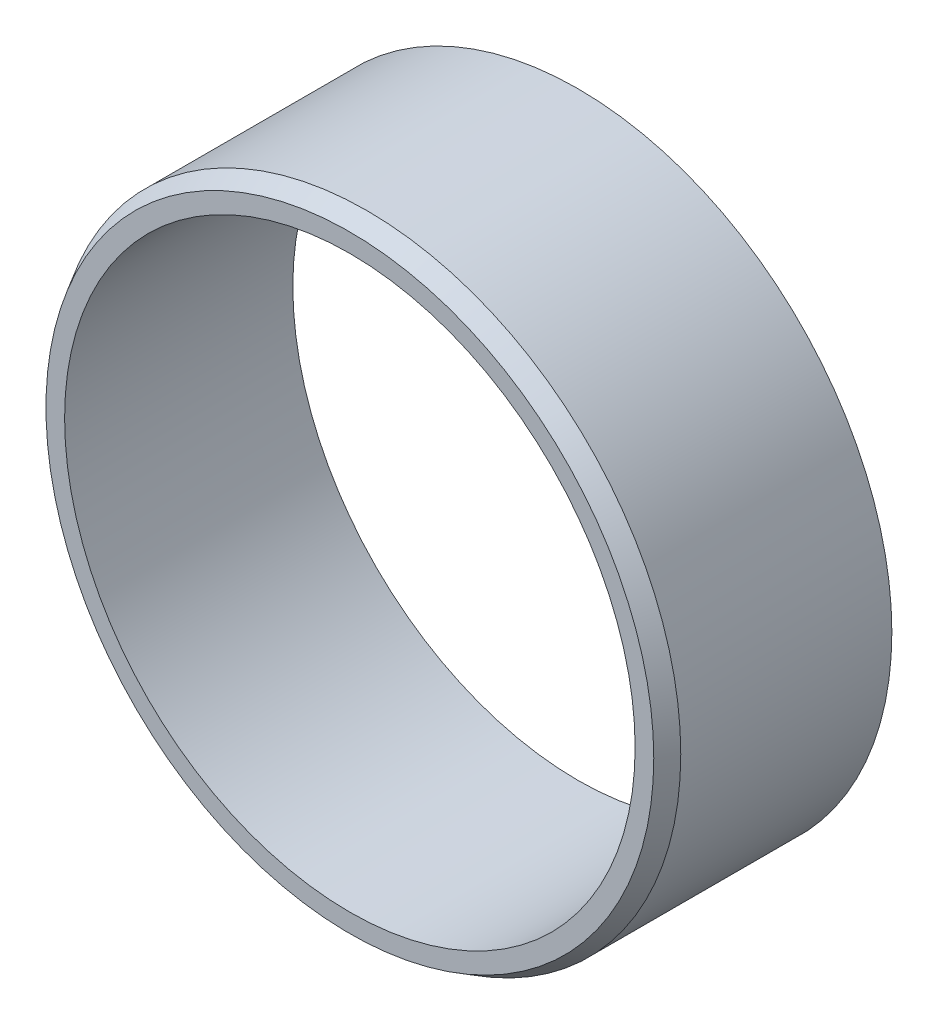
SolidWorks part; units mm, degrees
ref_plane "Face" through (0, 0, 0) normal (0, 0, 1) x (1, 0, 0)
ref_plane "Dessus" through (0, 0, 0) normal (0, 1, 0) x (1, 0, 0)
ref_plane "Droite" through (0, 0, 0) normal (1, 0, 0) x (0, 0, -1)
sketch "Esquisse1" plane through (0, 0, 0) normal (0, 0, 1) x (1, 0, 0)
  circle A0 centre (0, 0) radius 22
  circle A1 centre (0, 0) radius 20
  dimension "D1" = 40
  dimension "D2" = 44
extrude "Base-Extrusion" add sketch "Esquisse1" against normal blind 40
chamfer "Chanfrein1" distance 1.2 angle 30
chamfer "Chanfrein2" distance 0.5 angle 30
sketch "Esquisse2" plane through (0, 0, 0) normal (1, 0, 0) x (0, 0, -1)
  line L0 (40, -22) -> (40, 22) construction
  line L1 (40, 22) -> (1.2, 22) construction
  line L2 (40, 0) -> (40, 22)
  line L3 (40, 22) -> (16, 22)
  line L4 (-1.7859, 0) -> (42.1702, 0) construction
  line L5 (40, 0) -> (1.2, 0) construction
  line L6 (16, 22) -> (16, 0)
  line L7 (16, 0) -> (40, 0)
  dimension "D1" = 24
revolve "Enlèvement de matière-Révolution1" cut sketch "Esquisse2" angle 360 about L4
